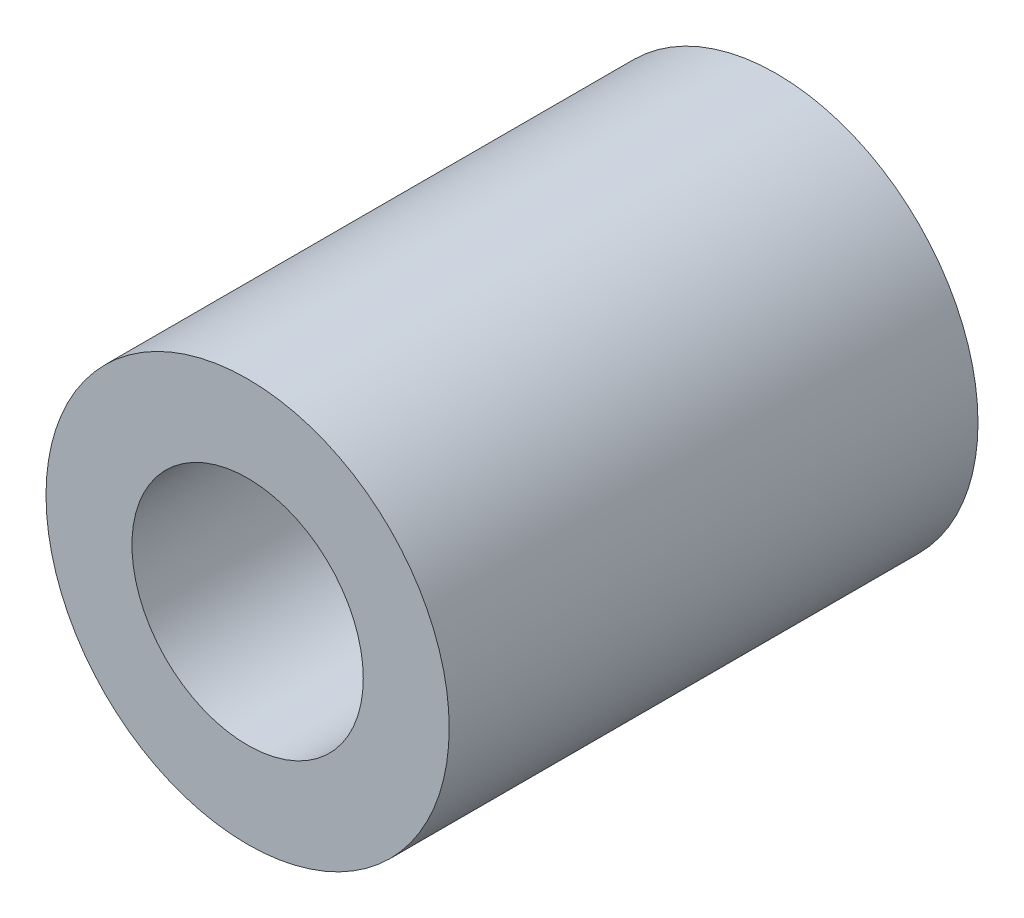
SolidWorks part; units mm, degrees
ref_plane "Front Plane" through (0, 0, 0) normal (0, 0, 1) x (1, 0, 0)
ref_plane "Top Plane" through (0, 0, 0) normal (0, 1, 0) x (1, 0, 0)
ref_plane "Right Plane" through (0, 0, 0) normal (1, 0, 0) x (0, 0, -1)
sketch "Sketch1" plane through (0, 0, 0) normal (0, 0, 1) x (1, 0, 0)
  circle A0 centre (0, 0) radius 1.75
  circle A1 centre (0, 0) radius 3.05
  dimension "D1" = 3.5
  dimension "D2" = 1.3
extrude "Boss-Extrude1" add sketch "Sketch1" along normal blind 8
